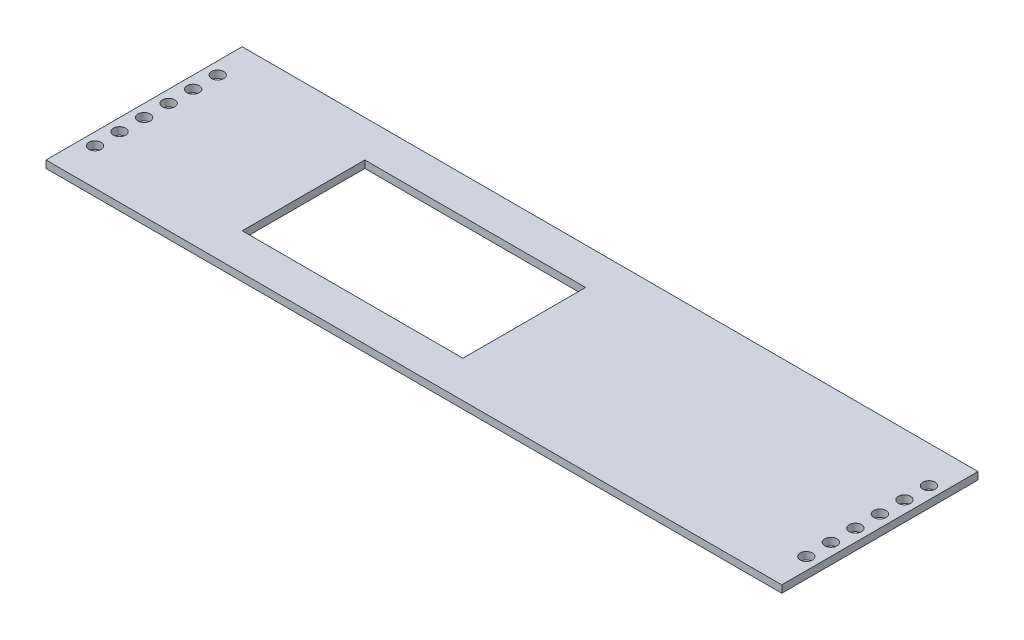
SolidWorks part; units mm, degrees
ref_plane "Front Plane" through (0, 0, 0) normal (0, 0, 1) x (1, 0, 0)
ref_plane "Top Plane" through (0, 0, 0) normal (0, 1, 0) x (1, 0, 0)
ref_plane "Right Plane" through (0, 0, 0) normal (1, 0, 0) x (0, 0, -1)
sketch "Sketch1" plane through (0, 0, 0) normal (0, 1, 0) x (1, 0, 0)
  line L1 (-300, -80) -> (300, -80)
  line L2 (-300, -80) -> (-300, 80)
  line L3 (-300, 80) -> (300, 80)
  line L4 (300, -80) -> (300, 80)
  line L5 (-300, -80) -> (300, 80) construction
  line L6 (-300, 80) -> (300, -80) construction
  point P0 (0, 0)
  dimension "D1" = 600
  dimension "D2" = 160
extrude "Boss-Extrude1" add sketch "Sketch1" along normal blind 6
sketch "Sketch2" plane through (0, 6, 0) normal (0, 1, 0) x (1, 0, 0)
  circle A0 centre (-290, -50) radius 5
  circle A1 centre (-290, -30) radius 5
  circle A2 centre (-290, -10) radius 5
  circle A3 centre (-290, 30) radius 5
  circle A4 centre (-290, 10) radius 5
  circle A5 centre (-290, 50) radius 5
  dimension "D1" = 10
  dimension "D2" = 20
extrude "Cut-Extrude1" cut sketch "Sketch2" against normal blind 6
mirror "Mirror1" about plane through (0, 0, 0) normal (1, 0, 0) of "Cut-Extrude1"
sketch "Sketch5" plane through (0, 6, 0) normal (0, 1, 0) x (1, 0, 0)
  line L1 (-170, -50) -> (10, -50)
  line L2 (-170, -50) -> (-170, 50)
  line L3 (-170, 50) -> (10, 50)
  line L4 (10, -50) -> (10, 50)
  line L5 (-170, -50) -> (10, 50) construction
  line L6 (-170, 50) -> (10, -50) construction
  point P0 (-80, 0)
  point P5 (0, 0)
  dimension "D1" = 100
  dimension "D2" = 180
  dimension "D3" = 80
extrude "Cut-Extrude2" cut sketch "Sketch5" against normal blind 10
